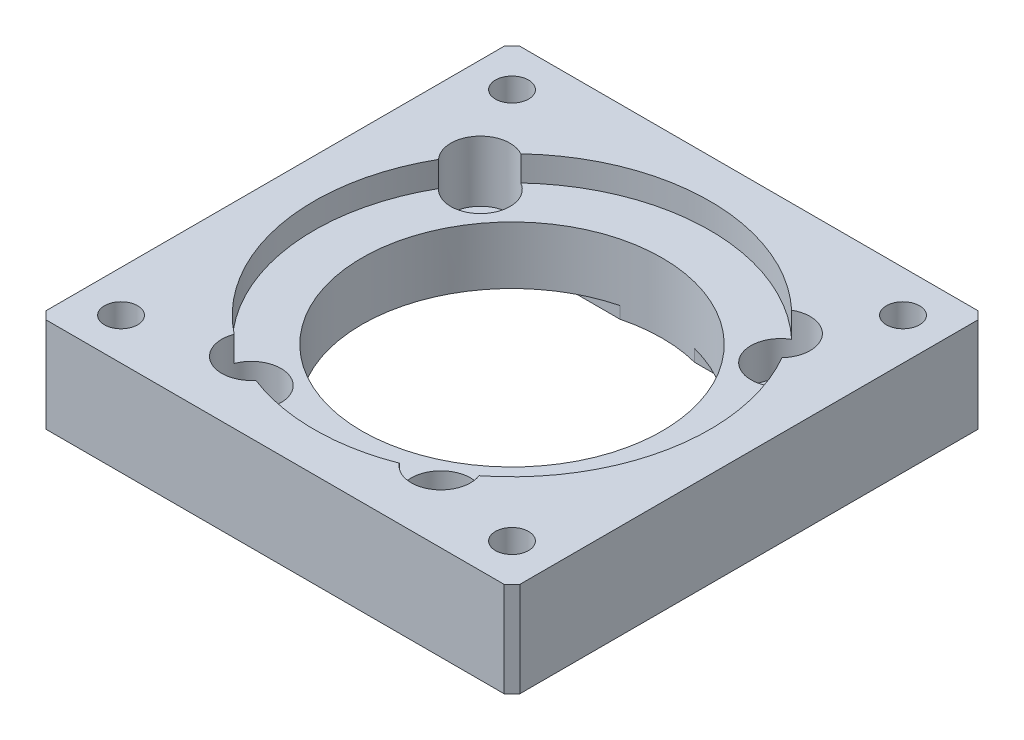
SolidWorks part; units mm, degrees
ref_plane "前视基准面" through (0, 0, 0) normal (0, 0, 1) x (1, 0, 0)
ref_plane "上视基准面" through (0, 0, 0) normal (0, 1, 0) x (1, 0, 0)
ref_plane "右视基准面" through (0, 0, 0) normal (1, 0, 0) x (0, 0, -1)
sketch "草图1" plane through (0, 0, 0) normal (0, 1, 0) x (1, 0, 0)
  line L1 (-30, -30) -> (30, -30)
  line L2 (-30, -30) -> (-30, 30)
  line L3 (-30, 30) -> (30, 30)
  line L4 (30, -30) -> (30, 30)
  line L5 (-30, -30) -> (30, 30) construction
  line L6 (-30, 30) -> (30, -30) construction
  point P0 (0, 0)
  dimension "D1" = 60
  dimension "D2" = 60
extrude "凸台-拉伸1" add sketch "草图1" along normal blind 12
sketch "草图2" plane through (0, 12, 0) normal (0, 1, 0) x (1, 0, 0)
  line L0 (0, 0) -> (17.5766, 0) construction
  circle A0 centre (0, 0) radius 19
  dimension "D1" = 38
extrude "切除-拉伸1" cut sketch "草图2" against normal blind 20
sketch "草图3" plane through (0, 0, 0) normal (0, -1, 0) x (1, 0, 0)
  line L0 (0, 30) -> (0, 0) construction
  line L1 (-30, 30) -> (30, 30) construction
  line L2 (0, 0) -> (34.2871, 0) construction
  line L4 (-19, 24) -> (19, 24)
  line L5 (-24, 19) -> (-24, -18.4)
  line L6 (-16, -18.4) -> (16, -18.4)
  line L7 (24, 19) -> (24, -18.4)
  arc A0 (24, 19) -> (19, 24) centre (19, 19) ccw
  arc A1 (-24, 19) -> (-19, 24) centre (-19, 19) cw
  arc A2 (-24, -18.4) -> (-16, -18.4) centre (-20, -18.4) ccw
  arc A3 (16, -18.4) -> (24, -18.4) centre (20, -18.4) ccw
  point P12 (24, 24)
  point P15 (-24, 24)
  dimension "D4" = 5
  dimension "D5" = 8
  dimension "D1" = 48
  dimension "D2" = 42.4
  dimension "D3" = 24
extrude "切除-拉伸2" cut sketch "草图3" against normal blind 1.5
sketch "草图4" plane through (0, 12, 0) normal (0, 1, 0) x (1, 0, 0)
  circle A0 centre (0, 0) radius 25.05
  dimension "D1" = 50.1
extrude "切除-拉伸3" cut sketch "草图4" against normal blind 3.2
chamfer "倒角1" distance 1 angle 45 4 edges at (30, 6, -30) (-30, 6, -30) (-30, 6, 30) (30, 6, 30)
sketch "草图5" plane through (0, 12, 0) normal (0, 1, 0) x (1, 0, 0)
  line L1 (-24.75, -24.75) -> (24.75, -24.75)
  line L2 (-24.75, -24.75) -> (-24.75, 24.75)
  line L3 (-24.75, 24.75) -> (24.75, 24.75)
  line L4 (24.75, -24.75) -> (24.75, 24.75)
  line L5 (-24.75, -24.75) -> (24.75, 24.75) construction
  line L6 (-24.75, 24.75) -> (24.75, -24.75) construction
  point P0 (0, 0)
  dimension "D1" = 49.5
  dimension "D2" = 49.5
hole_wizard "M5 螺纹孔1" positions "草图7" profile "草图6" tap size "M5" standard "Iso"
sketch "草图7" plane through (0, 12, 0) normal (0, 1, 0) x (1, 0, 0)
  point P0 (24.75, 24.75)
  point P3 (-24.75, 24.75)
  point P6 (-24.75, -24.75)
  point P9 (24.75, -24.75)
sketch "草图6" plane through (24.75, 12, -24.75) normal (1, 0, 0) x (0, 0, 1)
  line L0 (0, 0) -> (0, 23.6618)
  line L1 (0, 23.6618) -> (2.1, 22.4)
  line L2 (2.1, 22.4) -> (2.1, 0)
  line L5 (2.1, 0) -> (0, 0)
  line L10 (0, 23.6618) -> (-2.1, 22.4) construction
  line L11 (0, -6.35) -> (0, 107.95) construction
  dimension "螺纹孔钻头直径" = 4.2
  dimension "螺纹孔钻头深度" = 22.4
  dimension "导头角度" = 118
hole_wizard "打孔尺寸(%根据)内六角圆柱头螺钉的类型1" positions "草图9" profile "草图8" counterbore size "M4" standard "GB"
sketch "草图9" plane through (0, 12, 0) normal (0, 1, 0) x (1, 0, 0)
  point P0 (12, -21)
  point P3 (-12, -21)
  point P6 (-19, 15)
  point P9 (19, 15)
sketch "草图8" plane through (12, 12, 21) normal (1, 0, 0) x (0, 0, 1)
  line L0 (0, 0) -> (0, 11.3519)
  line L1 (0, 11.3519) -> (2.25, 10)
  line L2 (2.25, 10) -> (2.25, 7.7)
  line L3 (2.25, 7.7) -> (3.75, 7.7)
  line L4 (3.75, 7.7) -> (3.75, 0)
  line L5 (3.75, 0) -> (0, 0)
  line L10 (0, 11.3519) -> (-2.25, 10) construction
  line L11 (0, -6.35) -> (0, 107.95) construction
  dimension "孔直径" = 4.5
  dimension "孔深度" = 10
  dimension "柱形沉头孔直径" = 7.5
  dimension "柱形沉头孔深度" = 7.7
  dimension "导头角度" = 118
